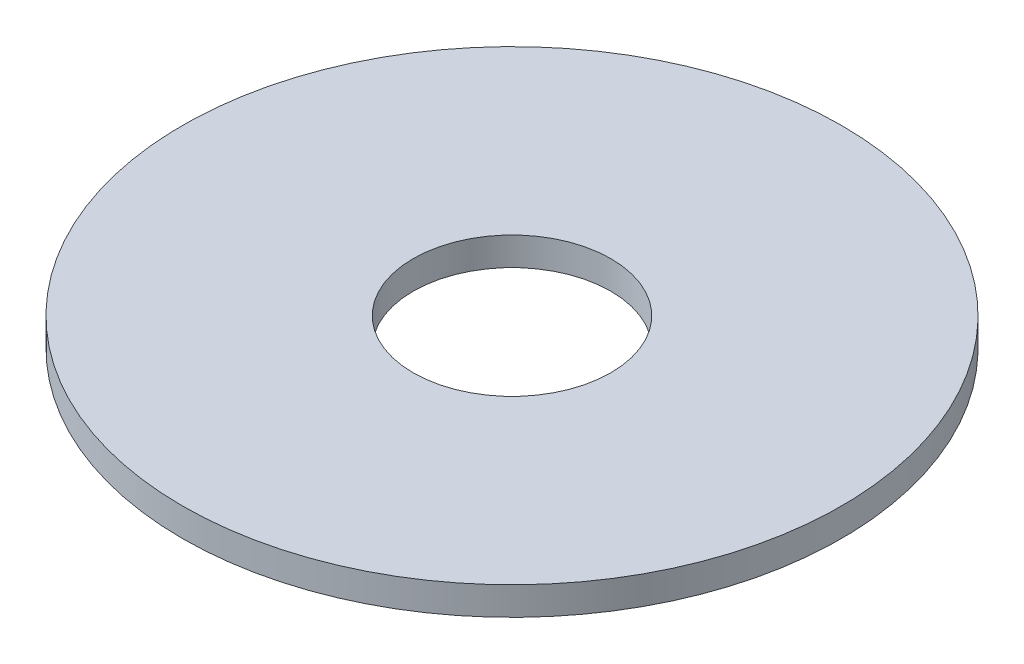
SolidWorks part; units mm, degrees
ref_plane "Plan de face" through (0, 0, 0) normal (0, 0, 1) x (1, 0, 0)
ref_plane "Plan de dessus" through (0, 0, 0) normal (0, 1, 0) x (1, 0, 0)
ref_plane "Plan de droite" through (0, 0, 0) normal (1, 0, 0) x (0, 0, -1)
sketch "Esquisse1" plane through (0, 0, 0) normal (0, 1, 0) x (1, 0, 0)
  circle A0 centre (0, 0) radius 35
  circle A1 centre (0, 0) radius 10.5
  dimension "D1" = 21
  dimension "D2" = 70
extrude "Extrusion1" add sketch "Esquisse1" along normal blind 3
